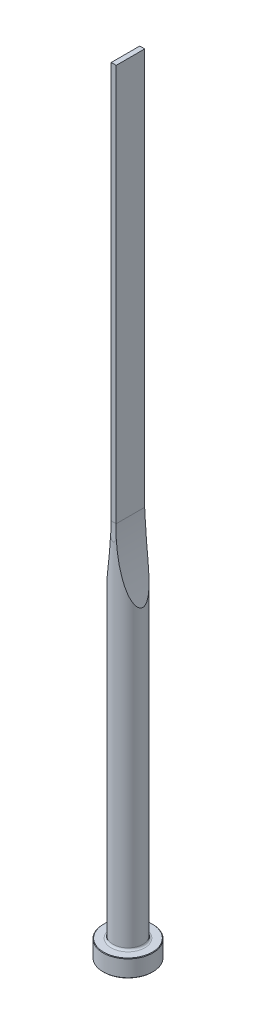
SolidWorks part; units mm, degrees
ref_plane "Front Plane" through (0, 0, 0) normal (0, 0, 1) x (1, 0, 0)
ref_plane "Top Plane" through (0, 0, 0) normal (0, 1, 0) x (1, 0, 0)
ref_plane "Right Plane" through (0, 0, 0) normal (1, 0, 0) x (0, 0, -1)
sketch "Sketch1" plane through (0, 0, 0) normal (0, 0, 1) x (1, 0, 0)
  line L0 (0, 0) -> (9.8, 0)
  line L1 (55, 0) -> (-55, 0) construction
  line L2 (10, 0.2) -> (10, 6.8)
  line L3 (9.8, 7) -> (6.8, 7)
  line L4 (6, 7.8) -> (6, 315)
  line L5 (0, 315) -> (6, 315)
  line L6 (10, 6.8) -> (9.8, 7)
  line L7 (9.8, 0) -> (10, 0.2)
  line L8 (0, 315) -> (0, 0)
  arc A0 (6, 7.8) -> (6.8, 7) centre (6.8, 7.8) ccw
  point P1 (10, 0)
  point P6 (10, 7)
  dimension "D4" = 0.8
  dimension "D1" = 6
  dimension "D2" = 10
  dimension "D3" = 7
  dimension "D5" = 315
revolve "Revolve1" add sketch "Sketch1" angle 360 about L8
sketch "Sketch2" plane through (0, 0, 0) normal (0, 0, 1) x (1, 0, 0)
  line L0 (1, 315) -> (1, 155)
  line L1 (6, 315) -> (-6, 315) construction
  line L2 (-1, 315) -> (-1, 155)
  line L3 (6, 315) -> (6, 125.4196)
  line L4 (-6, 315) -> (-6, 125.4196)
  line L5 (0, -11) -> (0, 11) construction
  line L6 (6, 315) -> (1, 315)
  line L8 (-1, 315) -> (-6, 315)
  arc A0 (1, 155) -> (6, 125.4196) centre (91, 155) ccw
  arc A1 (-1, 155) -> (-6, 125.4196) centre (-91, 155) cw
  dimension "D4" = 90
  dimension "D1" = 160
  dimension "D2" = 2
  dimension "D3" = 1
extrude "Cut-Extrude1" cut sketch "Sketch2" against normal mid plane 15
sketch "Sketch3" plane through (0, 0, 0) normal (1, 0, 0) x (0, 0, -1)
  line L0 (5.75, 315) -> (5.75, 155)
  line L1 (-5.9161, 315) -> (5.9161, 315) construction
  line L2 (-5.75, 315) -> (-5.75, 155)
  line L3 (6, 315) -> (6, 148.2965)
  line L4 (5.75, 315) -> (6, 315)
  line L5 (0, 11) -> (0, -11) construction
  line L6 (-6, 315) -> (-6, 148.2965)
  line L8 (-5.75, 315) -> (-6, 315)
  arc A0 (5.75, 155) -> (6, 148.2965) centre (95.75, 155) ccw
  arc A1 (-5.75, 155) -> (-6, 148.2965) centre (-95.75, 155) cw
  dimension "D2" = 90
  dimension "D1" = 160
  dimension "D3" = 11.5
  dimension "D4" = 5.75
extrude "Cut-Extrude2" cut sketch "Sketch3" against normal mid plane 15
